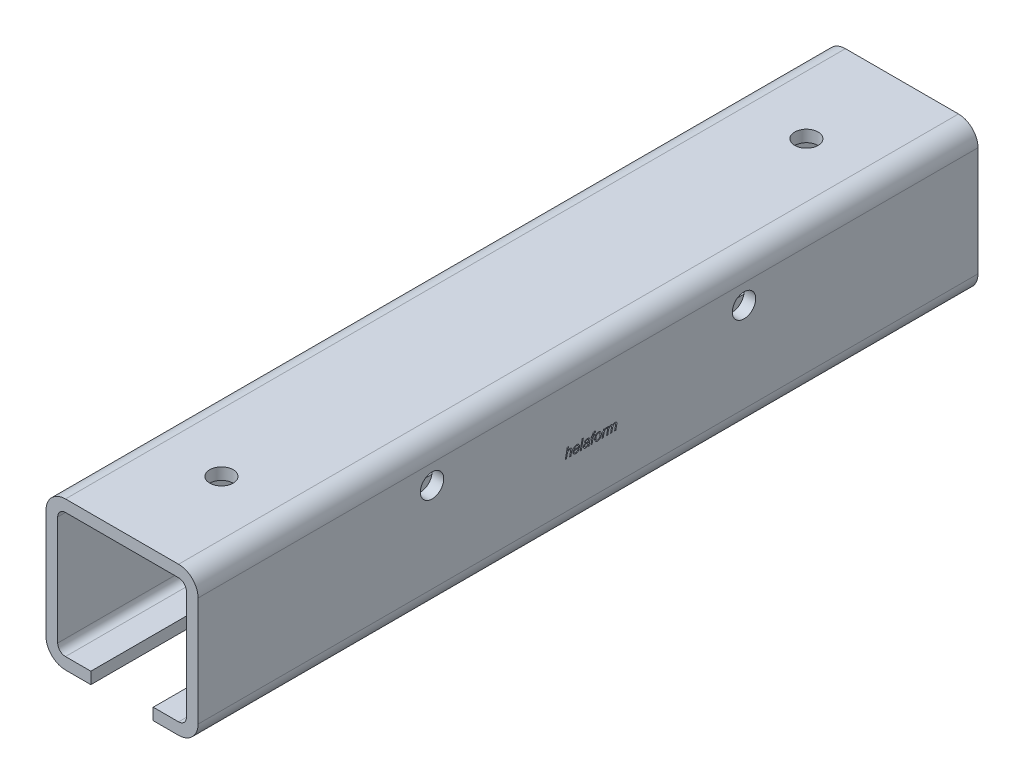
SolidWorks part; units mm, degrees
ref_plane "Front" through (0, 0, 0) normal (0, 0, 1) x (1, 0, 0)
ref_plane "Top" through (0, 0, 0) normal (0, 1, 0) x (1, 0, 0)
ref_plane "Right" through (0, 0, 0) normal (1, 0, 0) x (0, 0, -1)
sketch "Sketch1" plane through (0, 0, 0) normal (0, 0, 1) x (1, 0, 0)
  line L0 (0, 35.5247) -> (0, -19.9414) construction
  line L1 (0, 0) -> (14.5, 0)
  line L2 (19.5, -5) -> (19.5, -33)
  line L3 (14.5, -38) -> (8, -38)
  line L4 (0, -3) -> (14.5, -3)
  line L5 (16.5, -5) -> (16.5, -33)
  line L6 (14.5, -35) -> (8, -35)
  line L7 (8, -35) -> (8, -38)
  line L8 (-8, -35) -> (-8, -38)
  line L9 (-14.5, -35) -> (-8, -35)
  line L10 (-16.5, -5) -> (-16.5, -33)
  line L11 (0, -3) -> (-14.5, -3)
  line L12 (-14.5, -38) -> (-8, -38)
  line L13 (-19.5, -5) -> (-19.5, -33)
  line L14 (0, 0) -> (-14.5, 0)
  arc A0 (14.5, 0) -> (19.5, -5) centre (14.5, -5) cw
  arc A1 (19.5, -33) -> (14.5, -38) centre (14.5, -33) cw
  arc A2 (14.5, -3) -> (16.5, -5) centre (14.5, -5) cw
  arc A3 (16.5, -33) -> (14.5, -35) centre (14.5, -33) cw
  arc A4 (-16.5, -33) -> (-14.5, -35) centre (-14.5, -33) ccw
  arc A5 (-14.5, -3) -> (-16.5, -5) centre (-14.5, -5) ccw
  arc A6 (-19.5, -33) -> (-14.5, -38) centre (-14.5, -33) ccw
  arc A7 (-14.5, 0) -> (-19.5, -5) centre (-14.5, -5) ccw
  dimension "D1" = 5
  dimension "D2" = 39
  dimension "D3" = 16
  dimension "D4" = 38
  dimension "D5" = 3
extrude "Extrude1" add sketch "Sketch1" along normal mid plane 200
sketch "Sketch2" plane through (0, 0, 0) normal (0, 1, 0) x (1, 0, 0)
  line L0 (-19.5, -100) -> (-19.5, 100) construction
  line L2 (14.5, 0) -> (-14.5, 0) construction
  line L3 (14.5, -100) -> (14.5, 100) construction
  line L4 (-14.5, -100) -> (-14.5, 100) construction
  circle A0 centre (0.5, -75) radius 3
  circle A1 centre (0.5, 75) radius 3
  dimension "D1" = 6
  dimension "D3" = 20
  dimension "D2" = 150
extrude "Extrude2" cut sketch "Sketch2" against normal up to next
sketch "Sketch3" plane through (19.5, 0, 0) normal (1, 0, 0) x (0, 0, -1)
  line L0 (100, -33) -> (100, -5) construction
  line L1 (-100, 0) -> (100, 0) construction
  circle A0 centre (-40, -10) radius 3
  circle A1 centre (40, -10) radius 3
  dimension "D1" = 6
  dimension "D2" = 80
  dimension "D3" = 60
  dimension "D4" = 10
extrude "Extrude3" cut sketch "Sketch3" against normal up to next
sketch "Sketch4" plane through (19.5, 0, 0) normal (1, 0, 0) x (0, 0, -1)
  line L0 (-100, -19) -> (100, -19) construction
  line L3 (0, -5) -> (0, -33) construction
  line L6 (-100, -5) -> (100, -5) construction
  line L7 (-100, -33) -> (100, -33) construction
  line L8 (100, -33) -> (100, -5) construction
  line L9 (-100, -33) -> (-100, -5) construction
  text T0 "helaform" font "Arial" height 2.5
extrude "Cut-Extrude1" cut sketch "Sketch4" against normal blind 1
